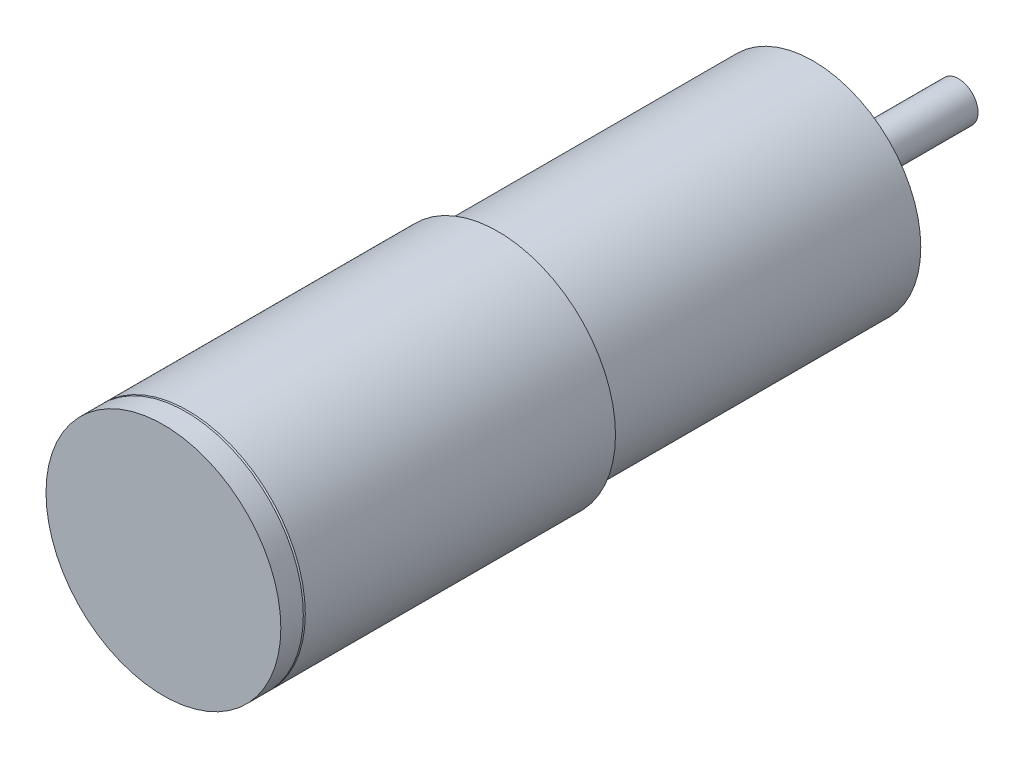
SolidWorks part; units mm, degrees
ref_plane "Front" through (0, 0, 0) normal (0, 0, 1) x (1, 0, 0)
ref_plane "Top" through (0, 0, 0) normal (0, 1, 0) x (1, 0, 0)
ref_plane "Right" through (0, 0, 0) normal (1, 0, 0) x (0, 0, -1)
sketch "Sketch1" plane through (0, 0, 0) normal (0, 0, 1) x (1, 0, 0)
  circle A0 centre (0, 0) radius 11
  dimension "D1" = 22
extrude "Extrude1" add sketch "Sketch1" along normal blind 32.2
chamfer "Chamfer1" distance 0.381 angle 45
sketch "Sketch2" plane through (0, 0, 32.2) normal (0, 0, 1) x (1, 0, 0)
  circle A0 centre (0, 0) radius 12
  circle A2 centre (0, 0) radius 11 construction
  dimension "D1" = 24
extrude "Extrude2" add sketch "Sketch2" along normal blind 31.9
sketch "Sketch3" plane through (0, 0, 0) normal (0, 0, -1) x (-1, 0, 0)
  circle A0 centre (0, 0) radius 5
  circle A1 centre (0, 0) radius 11 construction
  dimension "D1" = 10
extrude "Extrude3" add sketch "Sketch3" along normal blind 3.15
sketch "Sketch5" plane through (0, 0, 0) normal (0, 0, -1) x (-1, 0, 0)
  circle A0 centre (0, 0) radius 2
  circle A1 centre (0, 0) radius 11 construction
  dimension "D1" = 4
extrude "Extrude4" add sketch "Sketch5" along normal blind 14.85
chamfer "Chamfer2" distance 0.2 angle 45
sketch "Sketch6" plane through (0, 0, 64.1) normal (0, 0, 1) x (1, 0, 0)
  circle A0 centre (0, 0) radius 12
  circle A1 centre (0, 0) radius 12 construction
extrude "Extrude5" add sketch "Sketch6" along normal blind 2.3
sketch "Sketch7" plane through (0, 0, -3.15) normal (0, 0, -1) x (-1, 0, 0)
  circle A0 centre (0, 0) radius 3.5
  circle A1 centre (0, 0) radius 5 construction
  dimension "D1" = 7
extrude "Cut-Extrude1" cut sketch "Sketch7" against normal blind 1.8 flip side to cut
